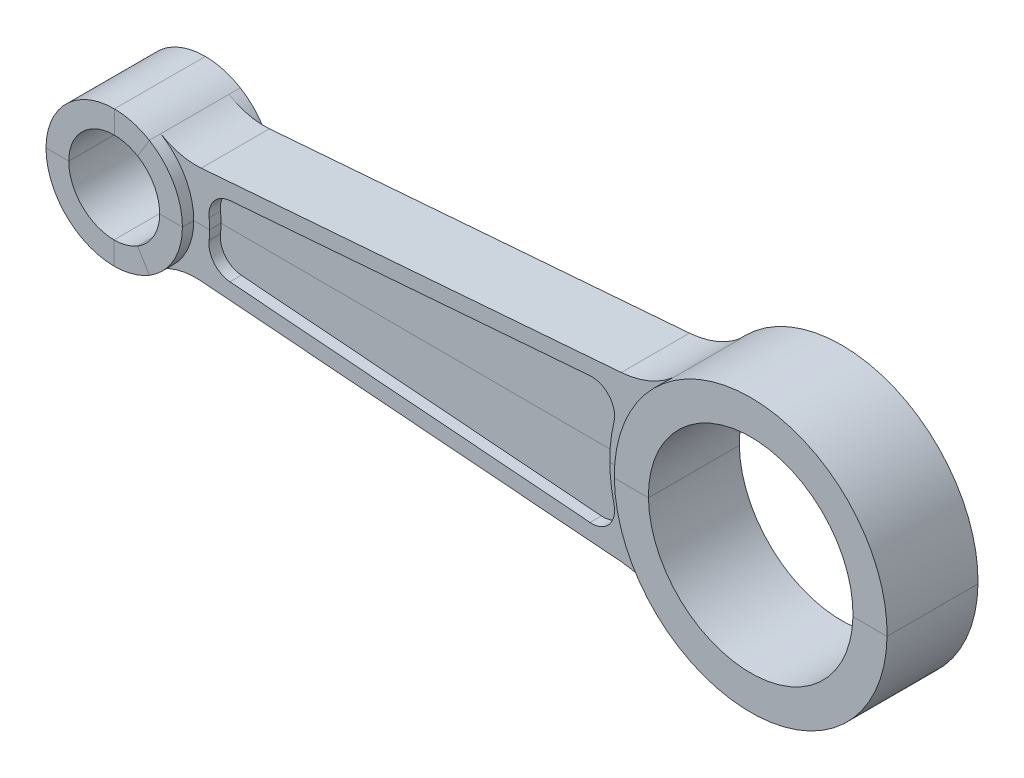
SolidWorks part; units mm, degrees
ref_plane "Front Plane" through (0, 0, 0) normal (0, 0, 1) x (1, 0, 0)
ref_plane "Top Plane" through (0, 0, 0) normal (0, 1, 0) x (1, 0, 0)
ref_plane "Right Plane" through (0, 0, 0) normal (1, 0, 0) x (0, 0, -1)
sketch "Sketch1" plane through (0, 0, 0) normal (0, 1, 0) x (1, 0, 0)
  line L0 (38.1, 25.4) -> (0, 25.4)
  line L1 (0, 25.4) -> (0, 19.05)
  line L2 (0, 19.05) -> (38.1, 19.05)
  line L3 (38.1, 19.05) -> (38.1, 25.4)
  line L4 (0, 25.4) -> (0, 19.05) construction
revolve "Revolve1" add sketch "Sketch1" angle 360 about L4
sketch "Sketch2" plane through (0, 0, -19.05) normal (0, 0, 1) x (1, 0, 0)
  line L0 (295.8347, -47.271) -> (42.2666, -27.3147)
  line L1 (42.2666, 27.3147) -> (295.8347, 47.271)
  arc A0 (295.8347, 47.271) -> (295.8347, -47.271) centre (355.6, 0) cw
  arc A1 (42.2666, -27.3147) -> (19.6386, -32.6486) centre (39.2773, -65.2973) ccw
  arc A2 (19.6386, -32.6486) -> (19.6386, 32.6486) centre (0, 0) cw
  arc A3 (19.6386, 32.6486) -> (42.2666, 27.3147) centre (39.2773, 65.2973) ccw
extrude "Boss-Extrude1" add sketch "Sketch2" along normal blind 44.45
sketch "Sketch3" plane through (0, 0, 25.4) normal (0, 0, 1) x (1, 0, 0)
  line L0 (42.2666, -27.3147) -> (295.8347, -47.271)
  line L1 (295.8347, 47.271) -> (42.2666, 27.3147)
  arc A0 (295.8347, -47.271) -> (295.8347, 47.271) centre (355.6, 0) cw
  arc A1 (42.2666, 27.3147) -> (19.6386, 32.6486) centre (39.2773, 65.2973) cw
  arc A2 (19.6386, 32.6486) -> (19.6386, -32.6486) centre (0, 0) cw
  arc A3 (19.6386, -32.6486) -> (42.2666, -27.3147) centre (39.2773, -65.2973) cw
extrude "Cut-Extrude1" cut sketch "Sketch3" against normal blind 6.35
sketch "Sketch4" plane through (0, 0, -19.05) normal (0, 0, -1) x (-1, 0, 0)
  circle A0 centre (-355.6, 0) radius 76.2
extrude "Boss-Extrude2" add sketch "Sketch4" along normal blind 6.35
sketch "Sketch5" plane through (0, 0, -19.05) normal (0, 0, -1) x (-1, 0, 0)
  line L0 (-43.2073, 18.4713) -> (-259.5169, 35.4952)
  line L1 (-259.5169, -35.4952) -> (-43.2073, -18.4713)
  arc A0 (-43.2073, -18.4713) -> (-43.2073, 18.4713) centre (0, 0) cw
  arc A1 (-259.5169, 35.4952) -> (-272.8622, 19.8689) centre (-260.5133, 22.8344) ccw
  arc A2 (-272.8622, 19.8689) -> (-272.8622, -19.8689) centre (-355.6, 0) cw
  arc A3 (-272.8622, -19.8689) -> (-259.5169, -35.4952) centre (-260.5133, -22.8344) ccw
extrude "Cut-Extrude2" cut sketch "Sketch5" against normal blind 6.35
sketch "Sketch6" plane through (0, 0, 19.05) normal (0, 0, 1) x (1, 0, 0)
  line L0 (259.5169, 35.4952) -> (43.2073, 18.4713)
  line L1 (43.2073, -18.4713) -> (259.5169, -35.4952)
  arc A0 (43.2073, 18.4713) -> (43.2073, -18.4713) centre (0, 0) cw
  arc A1 (259.5169, -35.4952) -> (272.8622, -19.8689) centre (260.5133, -22.8344) ccw
  arc A2 (272.8622, -19.8689) -> (272.8622, 19.8689) centre (355.6, 0) cw
  arc A3 (272.8622, 19.8689) -> (259.5169, 35.4952) centre (260.5133, 22.8344) ccw
extrude "Cut-Extrude3" cut sketch "Sketch6" against normal blind 6.35
hole_wizard "Hole1" positions "Sketch8" profile "Sketch7" legacy
sketch "Sketch8" plane through (0, 0, 25.4) normal (0, 0, 1) x (1, 0, 0)
  point P0 (355.6, 0)
sketch "Sketch7" plane through (355.6, 0, 25.4) normal (1, 0, 0) x (0, -1, 0)
  line L0 (0, 0) -> (0, 50.8)
  line L1 (0, 50.8) -> (57.15, 50.8)
  line L2 (57.15, 50.8) -> (57.15, 0)
  line L3 (57.15, 0) -> (0, 0)
  line L4 (0, 110) -> (0, -10) construction
  dimension "Diameter" = 114.3
  dimension "Depth" = 50.8
hole_wizard "Hole2" positions "Sketch10" profile "Sketch9" legacy
sketch "Sketch10" plane through (0, 0, 25.4) normal (0, 0, 1) x (1, 0, 0)
  point P0 (0, 0)
sketch "Sketch9" plane through (0, 0, 25.4) normal (1, 0, 0) x (0, -1, 0)
  line L0 (0, 0) -> (0, 50.8)
  line L1 (0, 50.8) -> (25.4, 50.8)
  line L2 (25.4, 50.8) -> (25.4, 0)
  line L3 (25.4, 0) -> (0, 0)
  line L4 (0, 110) -> (0, -10) construction
  dimension "Diameter" = 50.8
  dimension "Depth" = 50.8
fillet "Fillet1" radius 12.7 4 edges at (43.2073, 18.4713, 15.875) (43.2073, -18.4713, 15.875) (43.2073, 18.4713, -15.875) (43.2073, -18.4713, -15.875)
fillet "Fillet2" radius 50.8 2 edges at (295.8347, -47.271, 0) (295.8347, 47.271, 0)
sketch "Sketch11" plane through (0, 0, 25.4) normal (0, 0, 1) x (1, 0, 0)
  line L0 (0, 0) -> (0.2425, 70.8754)
  line L1 (0, 0) -> (-0.1925, -56.2477)
  point P0 (0, 0)
sketch "Sketch12" plane through (0, 0, 25.4) normal (0, 0, 1) x (1, 0, 0)
  line L0 (0, 0) -> (26.9831, 44.8586)
  line L1 (0, 0) -> (34.612, -57.5414)
  line L2 (0, 0) -> (0.15, 44.3977) construction
  line L3 (0, 0) -> (-0.203, -60.1108) construction
  arc A0 (42.2666, -27.3147) -> (19.6386, -32.6486) centre (39.2773, -65.2973) ccw construction
  arc A1 (19.6386, 32.6486) -> (42.2666, 27.3147) centre (39.2773, 65.2973) ccw construction
  arc A2 (42.2666, -27.3147) -> (19.6386, -32.6486) centre (39.2773, -65.2973) ccw construction
  arc A3 (19.6386, 32.6486) -> (42.2666, 27.3147) centre (39.2773, 65.2973) ccw construction
  point P0 (0, 0)
sketch "Sketch13" plane through (0, 0, 25.4) normal (0, 0, 1) x (1, 0, 0)
  line L0 (0, 0) -> (481.892, -1.4393)
  line L1 (0, 0) -> (-73.6249, 0.2199)
  point P0 (0, 0)
